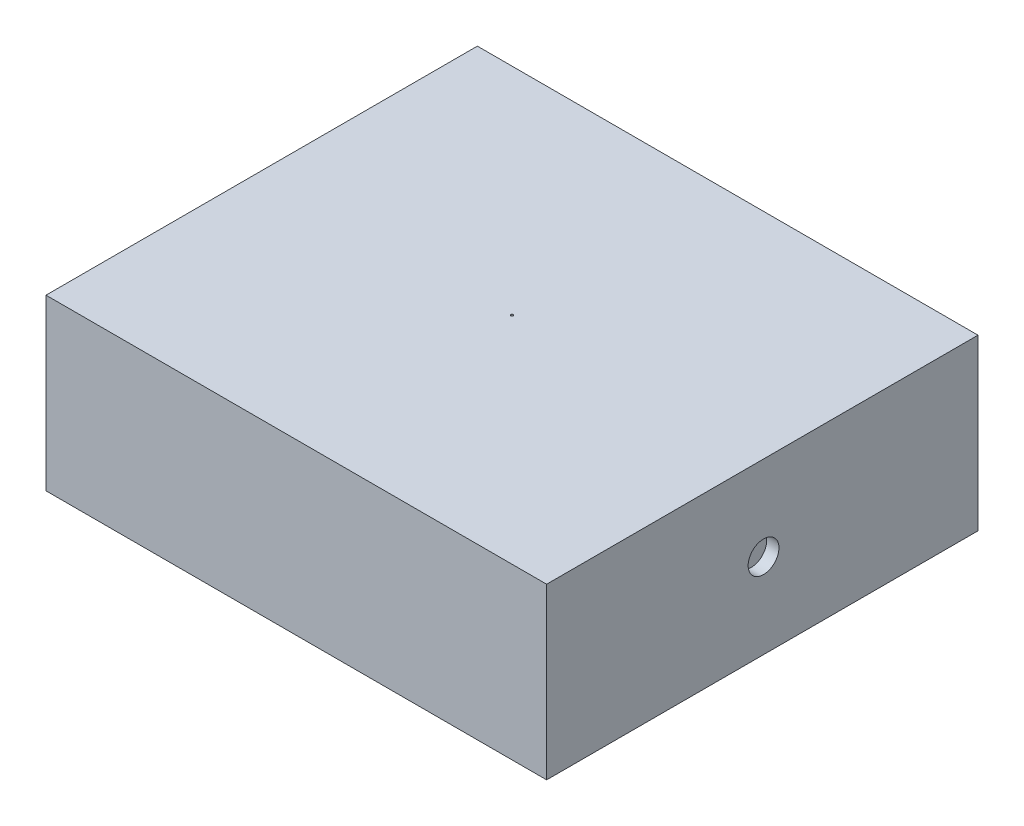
SolidWorks part; units mm, degrees
ref_plane "Front Plane" through (0, 0, 0) normal (0, 0, 1) x (1, 0, 0)
ref_plane "Top Plane" through (0, 0, 0) normal (0, 1, 0) x (1, 0, 0)
ref_plane "Right Plane" through (0, 0, 0) normal (1, 0, 0) x (0, 0, -1)
sketch "Sketch1" plane through (0, 0, 0) normal (0, 1, 0) x (1, 0, 0)
  line L1 (-51.5874, -44.45) -> (51.5874, -44.45)
  line L2 (-51.5874, -44.45) -> (-51.5874, 44.45)
  line L3 (-51.5874, 44.45) -> (51.5874, 44.45)
  line L4 (51.5874, -44.45) -> (51.5874, 44.45)
  dimension "D1" = 103.1748
  dimension "D2" = 51.5874
  dimension "D3" = 88.9
  dimension "D4" = 44.45
extrude "Boss-Extrude1" add sketch "Sketch1" against normal blind 34.925
sketch "Sketch3" plane through (0, 0, 0) normal (0, 1, 0) x (1, 0, 0)
  circle A0 centre (0, 0) radius 0.254
  dimension "D1" = 0.508
extrude "Cut-Extrude1" cut sketch "Sketch3" against normal through all
sketch "Sketch6" plane through (51.5874, 0, 0) normal (1, 0, 0) x (0, 0, -1)
  line L0 (-44.45, 0) -> (44.45, 0) construction
  circle A0 centre (0.254, -17.4498) radius 3.175
  dimension "D1" = 6.35
  dimension "D2" = 17.4498
extrude "Cut-Extrude2" cut sketch "Sketch6" against normal blind 2.54
